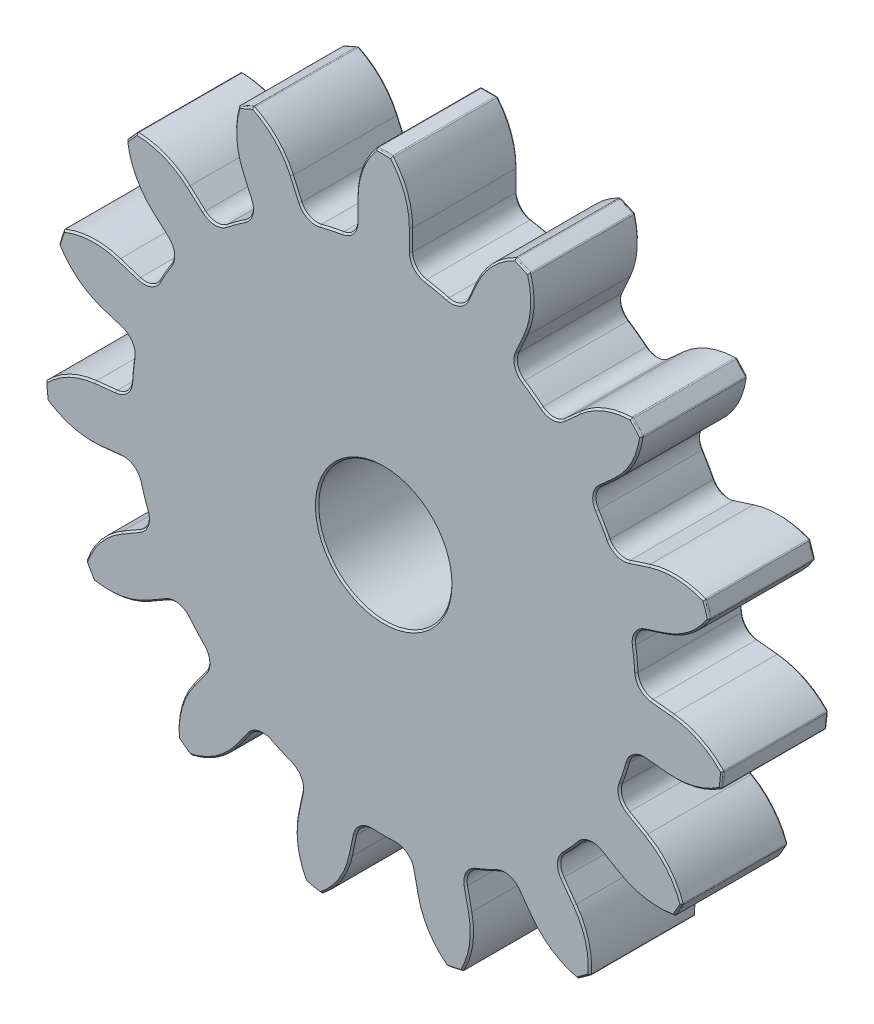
SolidWorks part; units mm, degrees
ref_plane "Спереди" through (0, 0, 0) normal (0, 0, 1) x (1, 0, 0)
ref_plane "Сверху" through (0, 0, 0) normal (0, 1, 0) x (1, 0, 0)
ref_plane "Справа" through (0, 0, 0) normal (1, 0, 0) x (0, 0, -1)
sketch "Эскиз1" plane through (0, 0, 0) normal (0, 0, 1) x (1, 0, 0)
  line L0 (0, 0) -> (0, 51) construction
  line L1 (0, 0) -> (-51, 0) construction
  line L2 (-4.1, 43.1274) -> (-4.1, 39.9925)
  line L3 (4.1, 43.1274) -> (4.1, 39.9925)
  line L4 (13.796, 41.0665) -> (12.5209, 38.2026)
  line L5 (21.287, 37.7312) -> (20.012, 34.8674)
  line L6 (29.3065, 31.9048) -> (26.9768, 29.8071)
  line L7 (34.7934, 25.811) -> (32.4637, 23.7133)
  line L8 (39.7496, 17.2264) -> (36.7682, 16.2577)
  line L9 (42.2836, 9.4278) -> (39.3021, 8.459)
  line L10 (43.3197, -0.4305) -> (40.202, -0.1028)
  line L11 (42.4626, -8.5856) -> (39.3449, -8.2579)
  line L12 (39.3994, -18.013) -> (36.6845, -16.4456)
  line L13 (35.2994, -25.1144) -> (32.5845, -23.547)
  line L14 (28.6666, -32.4809) -> (26.824, -29.9447)
  line L15 (22.0327, -37.3007) -> (20.19, -34.7646)
  line L16 (12.9771, -41.3325) -> (12.3253, -38.2662)
  line L17 (4.9563, -43.0374) -> (4.3045, -39.971)
  line L18 (-4.9563, -43.0374) -> (-4.3045, -39.971)
  line L19 (-12.9771, -41.3325) -> (-12.3253, -38.2662)
  line L20 (-22.0327, -37.3007) -> (-20.19, -34.7646)
  line L21 (-28.6666, -32.4809) -> (-26.824, -29.9447)
  line L22 (-35.2994, -25.1144) -> (-32.5845, -23.547)
  line L23 (-39.3994, -18.013) -> (-36.6845, -16.4456)
  line L24 (-42.4626, -8.5856) -> (-39.3449, -8.2579)
  line L25 (-43.3197, -0.4305) -> (-40.202, -0.1028)
  line L26 (-42.2836, 9.4278) -> (-39.3021, 8.459)
  line L27 (-39.7496, 17.2264) -> (-36.7682, 16.2577)
  line L28 (-34.7934, 25.811) -> (-32.4637, 23.7133)
  line L29 (-29.3065, 31.9048) -> (-26.9768, 29.8071)
  line L30 (-21.287, 37.7312) -> (-20.012, 34.8674)
  line L31 (-13.796, 41.0665) -> (-12.5209, 38.2026)
  arc A0 (1.1682, 50.9866) -> (-1.1682, 50.9866) centre (0, 0) ccw
  circle A1 centre (0, 0) radius 10
  arc A2 (-6.224, 37.4868) -> (-9.5614, 36.7774) centre (0, 0) ccw
  circle A3 centre (0, 0) radius 43.845 construction
  arc A4 (-1.1682, 50.9866) -> (-4.1, 43.1274) centre (7.9, 43.1274) ccw
  arc A5 (1.1682, 50.9866) -> (4.1, 43.1274) centre (-7.9, 43.1274) cw
  arc A6 (4.1, 39.9925) -> (6.224, 37.4868) centre (6.64, 39.9925) ccw
  arc A7 (-4.1, 39.9925) -> (-6.224, 37.4868) centre (-6.64, 39.9925) cw
  arc A8 (12.5209, 38.2026) -> (9.5614, 36.7774) centre (10.2005, 39.2357) cw
  arc A9 (19.6709, 47.0538) -> (13.796, 41.0665) centre (24.7585, 36.1856) ccw
  arc A10 (21.8054, 46.1034) -> (19.6709, 47.0538) centre (0, 0) ccw
  arc A11 (21.8054, 46.1034) -> (21.287, 37.7312) centre (10.3245, 42.6121) cw
  arc A12 (20.012, 34.8674) -> (20.9332, 31.7144) centre (22.3324, 33.8343) ccw
  arc A13 (26.9768, 29.8071) -> (23.6935, 29.7089) centre (25.2772, 31.6947) cw
  arc A14 (37.1087, 34.9849) -> (29.3065, 31.9048) centre (37.336, 22.987) ccw
  arc A15 (38.6721, 33.2485) -> (37.1087, 34.9849) centre (0, 0) ccw
  arc A16 (38.6721, 33.2485) -> (34.7934, 25.811) centre (26.7638, 34.7287) cw
  arc A17 (32.4637, 23.7133) -> (32.0228, 20.4583) centre (34.1633, 21.8257) ccw
  arc A18 (36.7682, 16.2577) -> (33.7288, 17.5034) centre (35.9833, 18.6734) cw
  arc A19 (48.1301, 16.8668) -> (39.7496, 17.2264) centre (43.4578, 5.8138) ccw
  arc A20 (48.8522, 14.6447) -> (48.1301, 16.8668) centre (0, 0) ccw
  arc A21 (48.8522, 14.6447) -> (42.2836, 9.4278) centre (38.5754, 20.8405) cw
  arc A22 (39.3021, 8.459) -> (37.5754, 5.6647) centre (40.087, 6.0434) ccw
  arc A23 (40.202, -0.1028) -> (37.9321, 2.2714) centre (40.4675, 2.4233) cw
  arc A24 (50.8294, -4.1677) -> (43.3197, -0.4305) centre (42.0654, -12.3648) ccw
  arc A25 (50.5852, -6.4914) -> (50.8294, -4.1677) centre (0, 0) ccw
  arc A26 (50.5852, -6.4914) -> (42.4626, -8.5856) centre (43.7169, 3.3487) cw
  arc A27 (39.3449, -8.2579) -> (36.6309, -10.1083) centre (39.0794, -10.784) ccw
  arc A28 (36.6845, -16.4456) -> (35.5765, -13.3533) centre (37.9545, -14.2459) cw
  arc A29 (44.7398, -24.4816) -> (39.3994, -18.013) centre (33.3994, -28.4053) ccw
  arc A30 (43.5716, -26.505) -> (44.7398, -24.4816) centre (0, 0) ccw
  arc A31 (43.5716, -26.505) -> (35.2994, -25.1144) centre (41.2994, -14.7221) cw
  arc A32 (32.5845, -23.547) -> (29.3526, -24.1335) centre (31.3145, -25.7467) ccw
  arc A33 (26.824, -29.9447) -> (27.0695, -26.6691) centre (28.8789, -28.4517) cw
  arc A34 (30.9143, -40.5624) -> (28.6666, -32.4809) centre (18.9584, -39.5343) ccw
  arc A35 (29.0241, -41.9357) -> (30.9143, -40.5624) centre (0, 0) ccw
  arc A36 (29.0241, -41.9357) -> (22.0327, -37.3007) centre (31.7409, -30.2473) cw
  arc A37 (20.19, -34.7646) -> (16.9989, -33.9858) centre (18.1351, -36.2575) ccw
  arc A38 (12.3253, -38.2662) -> (13.8819, -35.3736) centre (14.8098, -37.7381) cw
  arc A39 (11.7434, -49.6295) -> (12.9771, -41.3325) centre (1.2393, -43.8275) ccw
  arc A40 (9.458, -50.1153) -> (11.7434, -49.6295) centre (0, 0) ccw
  arc A41 (9.458, -50.1153) -> (4.9563, -43.0374) centre (16.6941, -40.5425) cw
  arc A42 (4.3045, -39.971) -> (1.706, -37.9617) centre (1.82, -40.4991) ccw
  arc A43 (-4.3045, -39.971) -> (-1.706, -37.9617) centre (-1.82, -40.4991) cw
  arc A44 (-9.458, -50.1153) -> (-4.9563, -43.0374) centre (-16.6941, -40.5425) ccw
  arc A45 (-11.7434, -49.6295) -> (-9.458, -50.1153) centre (0, 0) ccw
  arc A46 (-11.7434, -49.6295) -> (-12.9771, -41.3325) centre (-1.2393, -43.8275) cw
  arc A47 (-12.3253, -38.2662) -> (-13.8819, -35.3736) centre (-14.8098, -37.7381) ccw
  arc A48 (-20.19, -34.7646) -> (-16.9989, -33.9858) centre (-18.1351, -36.2575) cw
  arc A49 (-29.0241, -41.9357) -> (-22.0327, -37.3007) centre (-31.7409, -30.2473) ccw
  arc A50 (-30.9143, -40.5624) -> (-29.0241, -41.9357) centre (0, 0) ccw
  arc A51 (-30.9143, -40.5624) -> (-28.6666, -32.4809) centre (-18.9584, -39.5343) cw
  arc A52 (-26.824, -29.9447) -> (-27.0695, -26.6691) centre (-28.8789, -28.4517) ccw
  arc A53 (-32.5845, -23.547) -> (-29.3526, -24.1335) centre (-31.3145, -25.7467) cw
  arc A54 (-43.5716, -26.505) -> (-35.2994, -25.1144) centre (-41.2994, -14.7221) ccw
  arc A55 (-44.7398, -24.4816) -> (-43.5716, -26.505) centre (0, 0) ccw
  arc A56 (-44.7398, -24.4816) -> (-39.3994, -18.013) centre (-33.3994, -28.4053) cw
  arc A57 (-36.6845, -16.4456) -> (-35.5765, -13.3533) centre (-37.9545, -14.2459) ccw
  arc A58 (-39.3449, -8.2579) -> (-36.6309, -10.1083) centre (-39.0794, -10.784) cw
  arc A59 (-50.5852, -6.4914) -> (-42.4626, -8.5856) centre (-43.7169, 3.3487) ccw
  arc A60 (-50.8294, -4.1677) -> (-50.5852, -6.4914) centre (0, 0) ccw
  arc A61 (-50.8294, -4.1677) -> (-43.3197, -0.4305) centre (-42.0654, -12.3648) cw
  arc A62 (-40.202, -0.1028) -> (-37.9321, 2.2714) centre (-40.4675, 2.4233) ccw
  arc A63 (-39.3021, 8.459) -> (-37.5754, 5.6647) centre (-40.087, 6.0434) cw
  arc A64 (-48.8522, 14.6447) -> (-42.2836, 9.4278) centre (-38.5754, 20.8405) ccw
  arc A65 (-48.1301, 16.8668) -> (-48.8522, 14.6447) centre (0, 0) ccw
  arc A66 (-48.1301, 16.8668) -> (-39.7496, 17.2264) centre (-43.4578, 5.8138) cw
  arc A67 (-36.7682, 16.2577) -> (-33.7288, 17.5034) centre (-35.9833, 18.6734) ccw
  arc A68 (-32.4637, 23.7133) -> (-32.0228, 20.4583) centre (-34.1633, 21.8257) cw
  arc A69 (-38.6721, 33.2485) -> (-34.7934, 25.811) centre (-26.7638, 34.7287) ccw
  arc A70 (-37.1087, 34.9849) -> (-38.6721, 33.2485) centre (0, 0) ccw
  arc A71 (-37.1087, 34.9849) -> (-29.3065, 31.9048) centre (-37.336, 22.987) cw
  arc A72 (-26.9768, 29.8071) -> (-23.6935, 29.7089) centre (-25.2772, 31.6947) ccw
  arc A73 (-20.012, 34.8674) -> (-20.9332, 31.7144) centre (-22.3324, 33.8343) cw
  arc A74 (-21.8054, 46.1034) -> (-21.287, 37.7312) centre (-10.3245, 42.6121) ccw
  arc A75 (-19.6709, 47.0538) -> (-21.8054, 46.1034) centre (0, 0) ccw
  arc A76 (-19.6709, 47.0538) -> (-13.796, 41.0665) centre (-24.7585, 36.1856) cw
  arc A77 (-12.5209, 38.2026) -> (-9.5614, 36.7774) centre (-10.2005, 39.2357) ccw
  arc A78 (9.5614, 36.7774) -> (6.224, 37.4868) centre (0, 0) ccw
  arc A79 (23.6935, 29.7089) -> (20.9332, 31.7144) centre (0, 0) ccw
  arc A80 (-20.9332, 31.7144) -> (-23.6935, 29.7089) centre (0, 0) ccw
  arc A81 (33.7288, 17.5034) -> (32.0228, 20.4583) centre (0, 0) ccw
  arc A82 (-32.0228, 20.4583) -> (-33.7288, 17.5034) centre (0, 0) ccw
  arc A83 (-37.5754, 5.6647) -> (-37.9321, 2.2714) centre (0, 0) ccw
  arc A84 (-36.6309, -10.1083) -> (-35.5765, -13.3533) centre (0, 0) ccw
  arc A85 (-29.3526, -24.1335) -> (-27.0695, -26.6691) centre (0, 0) ccw
  arc A86 (-16.9989, -33.9858) -> (-13.8819, -35.3736) centre (0, 0) ccw
  arc A87 (-1.706, -37.9617) -> (1.706, -37.9617) centre (0, 0) ccw
  arc A88 (13.8819, -35.3736) -> (16.9989, -33.9858) centre (0, 0) ccw
  arc A89 (27.0695, -26.6691) -> (29.3526, -24.1335) centre (0, 0) ccw
  arc A90 (35.5765, -13.3533) -> (36.6309, -10.1083) centre (0, 0) ccw
  arc A91 (37.9321, 2.2714) -> (37.5754, 5.6647) centre (0, 0) ccw
  point P16 (4.1, 37.7782)
  point P19 (-4.1, 37.7782)
  dimension "D1" = 102
  dimension "D2" = 20
  dimension "D3" = 76
  dimension "D4" = 87.69
  dimension "D6" = 24
  dimension "D7" = 2.54
  dimension "D5" = 8.2
  dimension "D8" = 15
extrude "Бобышка-Вытянуть1" add sketch "Эскиз1" along normal blind 16
chamfer "Фаска1" distance 0.25 angle 45 242 edges at (10, 0, 0) (4.1, 41.56, 0) (3.3432, 47.3215, 0) (0, 51, 0) (-3.3432, 47.3215, 0) (-4.1, 41.56, 0) (-4.7024, 38.3501, 0) (-7.9006, 37.1696, 0) (-11.3025, 36.9472, 0) (-13.1584, 39.6345, 0) (-16.1932, 44.5902, 0) (-20.7436, 46.5908, 0) (-22.3016, 41.8706, 0) (-20.6495, 36.2993, 0) (-19.8943, 33.1219, 0) (-22.3358, 30.7426, 0) (-25.3532, 29.1558, 0) (-28.1416, 30.8559, 0) (-32.9297, 34.1488, 0) (-37.9004, 34.1257, 0) (-37.4038, 29.1798, 0) (-33.6285, 24.7622, 0) (-31.6462, 22.1667, 0) (-32.909, 19, 0) (-35.02, 16.3231, 0) (-38.2589, 16.7421, 0) (-43.9723, 17.8027, 0) (-48.5039, 15.7599, 0) (-46.0386, 11.4436, 0) (-40.7929, 8.9434, 0) (-37.9263, 7.3786, 0) (-37.7918, 3.9721, 0) (-38.6316, 0.668, 0) (-41.7609, -0.2667, 0) (-47.4118, -1.6216, 0) (-50.7206, -5.331, 0) (-46.7128, -8.2713, 0) (-40.9037, -8.4217, 0) (-37.6485, -8.6854, 0) (-36.1401, -11.7426, 0) (-35.5634, -15.1026, 0) (-38.042, -17.2293, 0) (-42.6532, -20.7655, 0) (-44.1673, -25.5, 0) (-39.31, -26.5561, 0) (-33.942, -24.3307, 0) (-30.861, -23.2475, 0) (-28.2395, -25.427, 0) (-26.346, -28.2619, 0) (-27.7453, -31.2128, 0) (-30.5196, -36.3188, 0) (-29.977, -41.2599, 0) (-25.1102, -40.249, 0) (-21.1114, -36.0326, 0) (-18.7373, -33.7899, 0) (-15.456, -34.7147, 0) (-12.5731, -36.5344, 0) (-12.6512, -39.7993, 0) (-13.1088, -45.5923, 0) (-10.6035, -49.8855, 0) (-6.5686, -46.9825, 0) (-4.6304, -41.5042, 0) (-3.3738, -38.4898, 0) (0, -38, 0) (3.3738, -38.4898, 0) (4.6304, -41.5042, 0) (6.5686, -46.9825, 0) (10.6035, -49.8855, 0) (13.1088, -45.5923, 0) (12.6512, -39.7993, 0) (12.5731, -36.5344, 0) (15.456, -34.7147, 0) (18.7373, -33.7899, 0) (21.1114, -36.0326, 0) (25.1102, -40.249, 0) (29.977, -41.2599, 0) (30.5196, -36.3188, 0) (27.7453, -31.2128, 0) (26.346, -28.2619, 0) (28.2395, -25.427, 0) (30.861, -23.2475, 0) (33.942, -24.3307, 0) (39.31, -26.5561, 0) (44.1673, -25.5, 0) (42.6532, -20.7655, 0) (38.042, -17.2293, 0) (35.5634, -15.1026, 0) (36.1401, -11.7426, 0) (37.6485, -8.6854, 0) (40.9037, -8.4217, 0) (46.7128, -8.2713, 0) (50.7206, -5.331, 0) (47.4118, -1.6216, 0) (41.7609, -0.2667, 0) (38.6316, 0.668, 0) (37.7918, 3.9721, 0) (37.9263, 7.3786, 0) (40.7929, 8.9434, 0) (46.0386, 11.4436, 0) (48.5039, 15.7599, 0) (43.9723, 17.8027, 0) (38.2589, 16.7421, 0) (35.02, 16.3231, 0) (32.909, 19, 0) (31.6462, 22.1667, 0) (33.6285, 24.7622, 0) (37.4038, 29.1798, 0) (37.9004, 34.1257, 0) (32.9297, 34.1488, 0) (28.1416, 30.8559, 0) (25.3532, 29.1558, 0) (22.3358, 30.7426, 0) (19.8943, 33.1219, 0) (20.6495, 36.2993, 0) (22.3016, 41.8706, 0) (20.7436, 46.5908, 0) (16.1932, 44.5902, 0) (13.1584, 39.6345, 0) (11.3025, 36.9472, 0) (7.9006, 37.1696, 0) (4.7024, 38.3501, 0) (10, 0, 16) (7.9006, 37.1696, 16) (11.3025, 36.9472, 16) (13.1584, 39.6345, 16) (16.1932, 44.5902, 16) (20.7436, 46.5908, 16) (22.3016, 41.8706, 16) (20.6495, 36.2993, 16) (19.8943, 33.1219, 16) (22.3358, 30.7426, 16) (25.3532, 29.1558, 16) (28.1416, 30.8559, 16) (32.9297, 34.1488, 16) (37.9004, 34.1257, 16) (37.4038, 29.1798, 16) (33.6285, 24.7622, 16) (31.6462, 22.1667, 16) (32.909, 19, 16) (35.02, 16.3231, 16) (38.2589, 16.7421, 16) (43.9723, 17.8027, 16) (48.5039, 15.7599, 16) (46.0386, 11.4436, 16) (40.7929, 8.9434, 16) (37.9263, 7.3786, 16) (37.7918, 3.9721, 16) (38.6316, 0.668, 16) (41.7609, -0.2667, 16) (47.4118, -1.6216, 16) (50.7206, -5.331, 16) (46.7128, -8.2713, 16) (40.9037, -8.4217, 16) (37.6485, -8.6854, 16) (36.1401, -11.7426, 16) (35.5634, -15.1026, 16) (38.042, -17.2293, 16) (42.6532, -20.7655, 16) (44.1673, -25.5, 16) (39.31, -26.5561, 16) (33.942, -24.3307, 16) (30.861, -23.2475, 16) (28.2395, -25.427, 16) (26.346, -28.2619, 16) (27.7453, -31.2128, 16) (30.5196, -36.3188, 16) (29.977, -41.2599, 16) (25.1102, -40.249, 16) (21.1114, -36.0326, 16) (18.7373, -33.7899, 16) (15.456, -34.7147, 16) (12.5731, -36.5344, 16) (12.6512, -39.7993, 16) (13.1088, -45.5923, 16) (10.6035, -49.8855, 16) (6.5686, -46.9825, 16) (4.6304, -41.5042, 16) (3.3738, -38.4898, 16) (0, -38, 16) (-3.3738, -38.4898, 16) (-4.6304, -41.5042, 16) (-6.5686, -46.9825, 16) (-10.6035, -49.8855, 16) (-13.1088, -45.5923, 16) (-12.6512, -39.7993, 16) (-12.5731, -36.5344, 16) (-15.456, -34.7147, 16) (-18.7373, -33.7899, 16) (-21.1114, -36.0326, 16) (-25.1102, -40.249, 16) (-29.977, -41.2599, 16) (-30.5196, -36.3188, 16) (-27.7453, -31.2128, 16) (-26.346, -28.2619, 16) (-28.2395, -25.427, 16) (-30.861, -23.2475, 16) (-33.942, -24.3307, 16) (-39.31, -26.5561, 16) (-44.1673, -25.5, 16) (-42.6532, -20.7655, 16) (-38.042, -17.2293, 16) (-35.5634, -15.1026, 16) (-36.1401, -11.7426, 16) (-37.6485, -8.6854, 16) (-40.9037, -8.4217, 16) (-46.7128, -8.2713, 16) (-50.7206, -5.331, 16) (-47.4118, -1.6216, 16) (-41.7609, -0.2667, 16) (-38.6316, 0.668, 16) (-37.7918, 3.9721, 16) (-37.9263, 7.3786, 16) (-40.7929, 8.9434, 16) (-46.0386, 11.4436, 16) (-48.5039, 15.7599, 16) (-43.9723, 17.8027, 16) (-38.2589, 16.7421, 16) (-35.02, 16.3231, 16) (-32.909, 19, 16) (-31.6462, 22.1667, 16) (-33.6285, 24.7622, 16) (-37.4038, 29.1798, 16) (-37.9004, 34.1257, 16) (-32.9297, 34.1488, 16) (-28.1416, 30.8559, 16) (-25.3532, 29.1558, 16) (-22.3358, 30.7426, 16) (-19.8943, 33.1219, 16) (-20.6495, 36.2993, 16) (-22.3016, 41.8706, 16) (-20.7436, 46.5908, 16) (-16.1932, 44.5902, 16) (-13.1584, 39.6345, 16) (-11.3025, 36.9472, 16) (-7.9006, 37.1696, 16) (-4.7024, 38.3501, 16) (-4.1, 41.56, 16) (-3.3432, 47.3215, 16) (0, 51, 16) (3.3432, 47.3215, 16) (4.1, 41.56, 16) (4.7024, 38.3501, 16)
fillet "Скругление1" radius 0.25 60 edges at (29.977, -41.2599, 15.75) (30.9143, -40.5624, 8) (29.977, -41.2599, 0.25) (29.0241, -41.9357, 8) (10.6035, -49.8855, 15.75) (11.7434, -49.6295, 8) (10.6035, -49.8855, 0.25) (9.458, -50.1153, 8) (-10.6035, -49.8855, 15.75) (-9.458, -50.1153, 8) (-10.6035, -49.8855, 0.25) (-11.7434, -49.6295, 8) (-29.977, -41.2599, 15.75) (-29.0241, -41.9357, 8) (-29.977, -41.2599, 0.25) (-30.9143, -40.5624, 8) (-44.1673, -25.5, 15.75) (-43.5716, -26.505, 8) (-44.1673, -25.5, 0.25) (-44.7398, -24.4816, 8) (-50.7206, -5.331, 15.75) (-50.5852, -6.4914, 8) (-50.7206, -5.331, 0.25) (-50.8294, -4.1677, 8) (-48.5039, 15.7599, 15.75) (-48.8522, 14.6447, 8) (-48.5039, 15.7599, 0.25) (-48.1301, 16.8668, 8) (-37.9004, 34.1257, 15.75) (-38.6721, 33.2485, 8) (-37.9004, 34.1257, 0.25) (-37.1087, 34.9849, 8) (44.1673, -25.5, 15.75) (44.7398, -24.4816, 8) (44.1673, -25.5, 0.25) (43.5716, -26.505, 8) (50.7206, -5.331, 15.75) (50.8294, -4.1677, 8) (50.7206, -5.331, 0.25) (50.5852, -6.4914, 8) (48.5039, 15.7599, 15.75) (48.1301, 16.8668, 8) (48.5039, 15.7599, 0.25) (48.8522, 14.6447, 8) (37.9004, 34.1257, 15.75) (37.1087, 34.9849, 8) (37.9004, 34.1257, 0.25) (38.6721, 33.2485, 8) (20.7436, 46.5908, 15.75) (19.6709, 47.0538, 8) (20.7436, 46.5908, 0.25) (21.8054, 46.1034, 8) (0, 51, 15.75) (-1.1682, 50.9866, 8) (0, 51, 0.25) (1.1682, 50.9866, 8) (-20.7436, 46.5908, 15.75) (-21.8054, 46.1034, 8) (-20.7436, 46.5908, 0.25) (-19.6709, 47.0538, 8)
